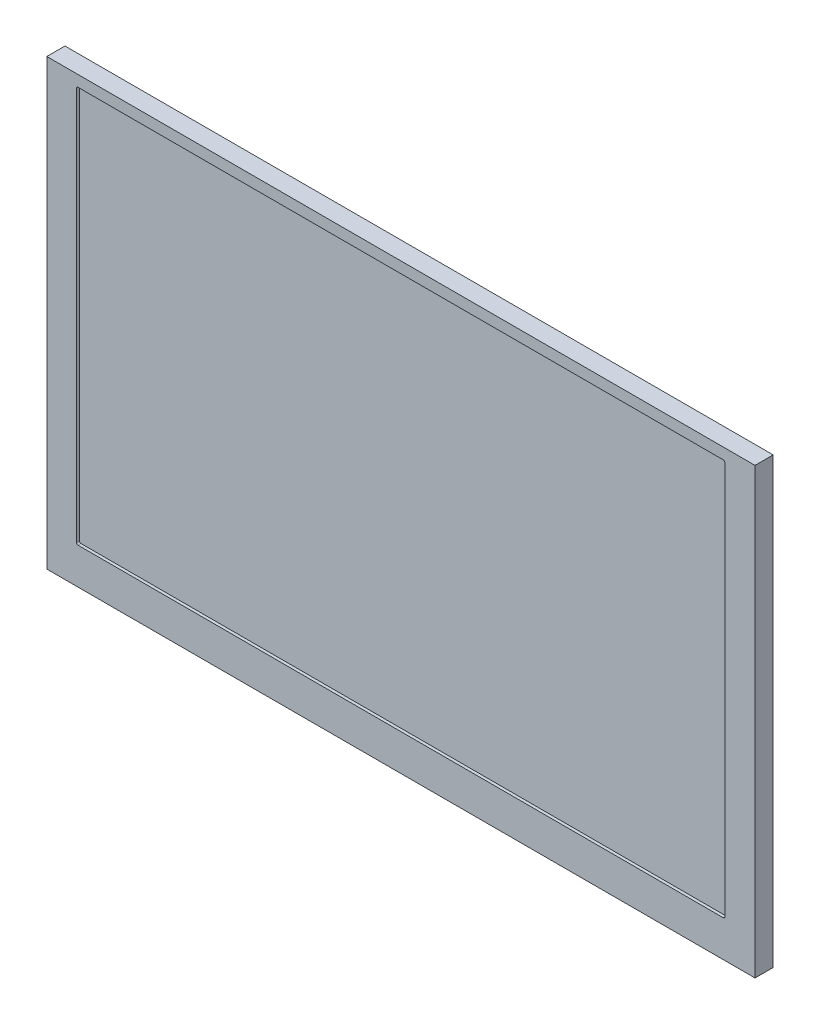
SolidWorks part; units mm, degrees
ref_plane "Front Plane" through (0, 0, 0) normal (0, 0, 1) x (1, 0, 0)
ref_plane "Top Plane" through (0, 0, 0) normal (0, 1, 0) x (1, 0, 0)
ref_plane "Right Plane" through (0, 0, 0) normal (1, 0, 0) x (0, 0, -1)
sketch "Sketch2" plane through (0, 0, 0) normal (0, 0, 1) x (1, 0, 0)
  line L1 (-60.5, 37.925) -> (60.5, 37.925)
  line L2 (-60.5, 37.925) -> (-60.5, -37.925)
  line L3 (-60.5, -37.925) -> (60.5, -37.925)
  line L4 (60.5, 37.925) -> (60.5, -37.925)
  dimension "D1" = 121
  dimension "D2" = 60.5
  dimension "D3" = 75.85
  dimension "D4" = 37.925
extrude "Boss-Extrude1" add sketch "Sketch2" along normal blind 3.1
sketch "Sketch3" plane through (0, 0, 3.1) normal (0, 0, 1) x (1, 0, 0)
  line L0 (55.35, -31.42) -> (55.35, 35.73)
  line L1 (55.05, 36.03) -> (-55.15, 36.03)
  line L2 (-55.45, 35.73) -> (-55.45, -31.42)
  line L3 (-55.15, -31.72) -> (55.05, -31.72)
  line L4 (-55.55, 83.2399) -> (-55.55, -51.3159) construction
  line L5 (-67.146, -31.72) -> (106.9851, -31.72) construction
  line L6 (-60.5, -37.925) -> (60.5, -37.925) construction
  line L7 (-60.5, 37.925) -> (-60.5, -37.925) construction
  arc A0 (55.05, -31.72) -> (55.35, -31.42) centre (55.05, -31.42) ccw
  arc A1 (55.35, 35.73) -> (55.05, 36.03) centre (55.05, 35.73) ccw
  arc A2 (-55.15, 36.03) -> (-55.45, 35.73) centre (-55.15, 35.73) ccw
  arc A3 (-55.45, -31.42) -> (-55.15, -31.72) centre (-55.15, -31.42) ccw
  dimension "D1" = 6.205
  dimension "D2" = 4.95
extrude "Cut-Extrude1" cut sketch "Sketch3" against normal blind 0.5
ref_plane "Plane2" through (0, 0, 2.5) normal (0, 0, 1) x (1, 0, 0)
sketch "Sketch5" plane through (0, 0, 2.5) normal (0, 0, 1) x (1, 0, 0)
